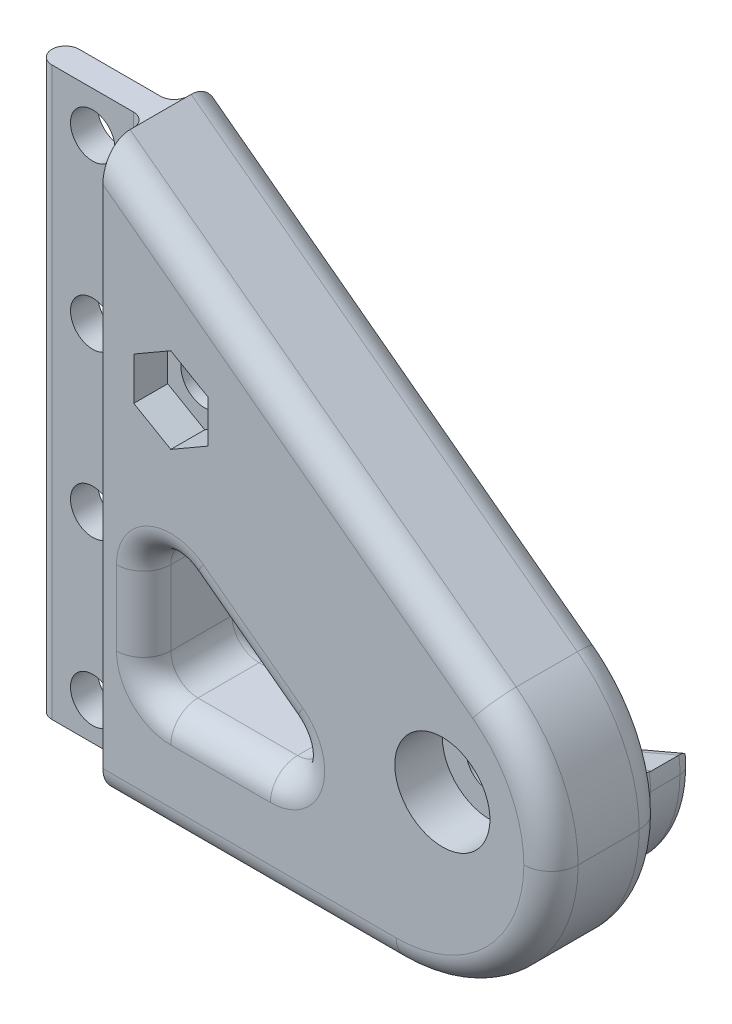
SolidWorks part; units mm, degrees
ref_plane "Front Plane" through (0, 0, 0) normal (0, 0, 1) x (1, 0, 0)
ref_plane "Top Plane" through (0, 0, 0) normal (0, 1, 0) x (1, 0, 0)
ref_plane "Right Plane" through (0, 0, 0) normal (1, 0, 0) x (0, 0, -1)
sketch "Sketch1" plane through (0, 0, 0) normal (0, 0, 1) x (1, 0, 0)
  line L5 (0, -14) -> (-20, 1) construction
  line L37 (8, -10) -> (8, -27)
  line L38 (-25, -27) -> (-25, 14.75)
  line L41 (-25, 14.75) -> (8, -10)
  line L48 (-25, -27) -> (8, -27)
  line L50 (-22, -19) -> (-6.6667, -19)
  line L52 (-6.6667, -19) -> (-22, -7.5)
  line L54 (-22, -7.5) -> (-22, -19)
  circle A1 centre (-20, 1) radius 1.75
  circle A2 centre (0, -14) radius 1.75
  dimension "D6" = 3.5
  dimension "D5" = 8
  dimension "D17" = 19
  dimension "D4" = 8
  dimension "D1" = 15
  dimension "D2" = 5
  dimension "D7" = 14
  dimension "D8" = 20
  dimension "D9" = 20
  dimension "D10" = 8
  dimension "D13" = 8
extrude "Boss-Extrude1" add sketch "Sketch1" along normal blind 8.5
sketch "Sketch3" plane through (0, 0, 0) normal (0, 0, -1) x (-1, 0, 0)
  line L0 (25, 14.75) -> (25, -27) construction
  line L1 (22.725, 2.5733) -> (20, 4.1466)
  line L2 (20, 4.1466) -> (17.275, 2.5733)
  line L3 (17.275, 2.5733) -> (17.275, -0.5733)
  line L4 (17.275, -0.5733) -> (20, -2.1466)
  line L5 (20, -2.1466) -> (22.725, -0.5733)
  line L6 (22.725, -0.5733) -> (22.725, 2.5733)
  circle A0 centre (20, 1) radius 2.725 construction
  dimension "D1" = 5.45
extrude "Cut-Extrude2" cut sketch "Sketch3" against normal blind 2.5
sketch "Sketch4" plane through (0, 0, 8.5) normal (0, 0, 1) x (1, 0, 0)
  line L0 (8, -10) -> (-25, 14.75) construction
  line L1 (-2.5172, -12.1121) -> (-2.8936, -15.236)
  line L2 (-2.8936, -15.236) -> (-0.3764, -17.124)
  line L3 (-0.3764, -17.124) -> (2.5172, -15.8879)
  line L4 (2.5172, -15.8879) -> (2.8936, -12.764)
  line L5 (2.8936, -12.764) -> (0.3764, -10.876)
  line L6 (0.3764, -10.876) -> (-2.5172, -12.1121)
  circle A0 centre (0, -14) radius 2.725 construction
  dimension "D1" = 5.45
extrude "Cut-Extrude3" cut sketch "Sketch4" against normal blind 2.5
sketch "Sketch5" plane through (0, 0, 8.5) normal (0, 0, 1) x (1, 0, 0)
  circle A0 centre (-20, 1) radius 3.5
  dimension "D1" = 7
extrude "Cut-Extrude4" cut sketch "Sketch5" against normal blind 3.5
sketch "Sketch6" plane through (0, 0, 0) normal (0, 0, -1) x (-1, 0, 0)
  circle A0 centre (0, -14) radius 3.5
  dimension "D1" = 7
extrude "Cut-Extrude5" cut sketch "Sketch6" against normal blind 3.5
sketch "Sketch7" plane through (-25, 0, 0) normal (-1, 0, 0) x (0, 0, 1)
  line L6 (8.5, -27) -> (0, -27) construction
  line L7 (3.25, -27) -> (5.25, -27)
  line L8 (3.25, -27) -> (3.25, 14.75)
  line L9 (3.25, 14.75) -> (5.25, 14.75)
  line L10 (5.25, -27) -> (5.25, 14.75)
  line L11 (8.5, 14.75) -> (0, 14.75) construction
  point P6 (4.25, -27)
  point P7 (4.25, -27)
  dimension "D1" = 2
extrude "Boss-Extrude2" add sketch "Sketch7" along normal blind 8
fillet "Fillet1" radius 11.4 2 edges at (8, -10, 4.25) (8, -27, 4.25)
fillet "Fillet2" radius 2 17 edges at (-14.3333, -13.25, 0) (-14.3333, -13.25, 8.5) (-22, -13.25, 0) (-22, -13.25, 8.5) (-14.2, -27, 0) (-14.2, -27, 8.5) (4.6433, -23.6787, 8.5) (4.6433, -23.6787, 0) (6.7853, -10.5794, 8.5) (6.7853, -10.5794, 0) (-6.6667, -19, 4.25) (-14.3333, -19, 0) (-14.3333, -19, 8.5) (-22, -19, 4.25) (-22, -7.5, 4.25) (-10.78, 4.085, 8.5) (-10.78, 4.085, 0)
mirror "Mirror1" about plane through (0, 0, 0) normal (0, 0, -1)
sketch "Sketch9" plane through (0, 14.75, 0) normal (0, 1, 0) x (1, 0, 0)
  line L1 (-25, 0) -> (14.3561, 0)
  line L3 (-25, -13.188) -> (14.3561, -13.188)
  line L4 (14.3561, 0) -> (14.3561, -13.188)
  line L5 (-25, 0) -> (-38.6068, 0)
  line L7 (-25, -13.188) -> (-38.6068, -13.188)
  line L8 (-38.6068, 0) -> (-38.6068, -13.188)
extrude "Cut-Extrude7" cut sketch "Sketch9" against normal through all
sketch "Sketch10" plane through (0, 0, -3.25) normal (0, 0, 1) x (1, 0, 0)
  line L0 (-29, 14.75) -> (-29, -27) construction
  line L1 (-33, 14.75) -> (-25, 14.75) construction
  line L2 (-33, -27) -> (-25, -27) construction
  circle A0 centre (-29, 11.75) radius 1.6364
  dimension "D1" = 3
extrude "Cut-Extrude8" cut sketch "Sketch10" against normal through all
pattern_linear "LPattern1" count 4 spacing 12 along (0, -1, 0) of "Cut-Extrude8"
fillet "Fillet3" radius 1 6 edges at (-25, -6.125, -3.25) (-25, -6.125, -5.25) (-33, -27, -4.25) (-33, -6.125, -3.25) (-33, -6.125, -5.25) (-33, 14.75, -4.25)
sketch "Sketch11" plane through (0, 0, -8.5) normal (0, 0, -1) x (-1, 0, 0)
  line L0 (2.8936, -15.236) -> (-1.5923, -23.5647)
  line L10 (-2.5172, -15.8879) -> (-1.5923, -23.5647) construction
  line L11 (2.8936, -15.236) -> (0.3764, -17.124)
  line L12 (0.3764, -17.124) -> (-2.5172, -15.8879)
  line L13 (-2.5172, -15.8879) -> (-5.9147, -14.4367)
  line L14 (-2.5172, -15.8879) -> (-2.8936, -12.764) construction
  arc A0 (-2.24, -8.18) -> (-5.9999, -15.65) centre (3.4, -15.7) ccw construction
  arc A1 (-1.5923, -23.5647) -> (-5.9999, -15.65) centre (3.4, -15.6) cw
  arc A2 (-5.9999, -15.65) -> (-5.9147, -14.4367) centre (2.0754, -15.607) cw
  arc A3 (-5.9999, -15.65) -> (3.4, -25) centre (3.4, -15.6) ccw construction
  point P1 (-3.1078, -22.383)
  point P2 (0, 0)
  point P8 (0, 0)
  point P14 (-5.9147, -15.7554)
  point P15 (-5.9999, -14.4367)
  point P16 (-1.5923, -23.5647)
extrude "Boss-Extrude3" add sketch "Sketch11" along normal blind 4
fillet "Fillet5" radius 1 7 edges at (-0.6506, -19.4004, -8.5) (-1.635, -16.18, -12.5) (2.7692, -15.7803, -12.5) (4.8125, -20.1733, -12.5)
